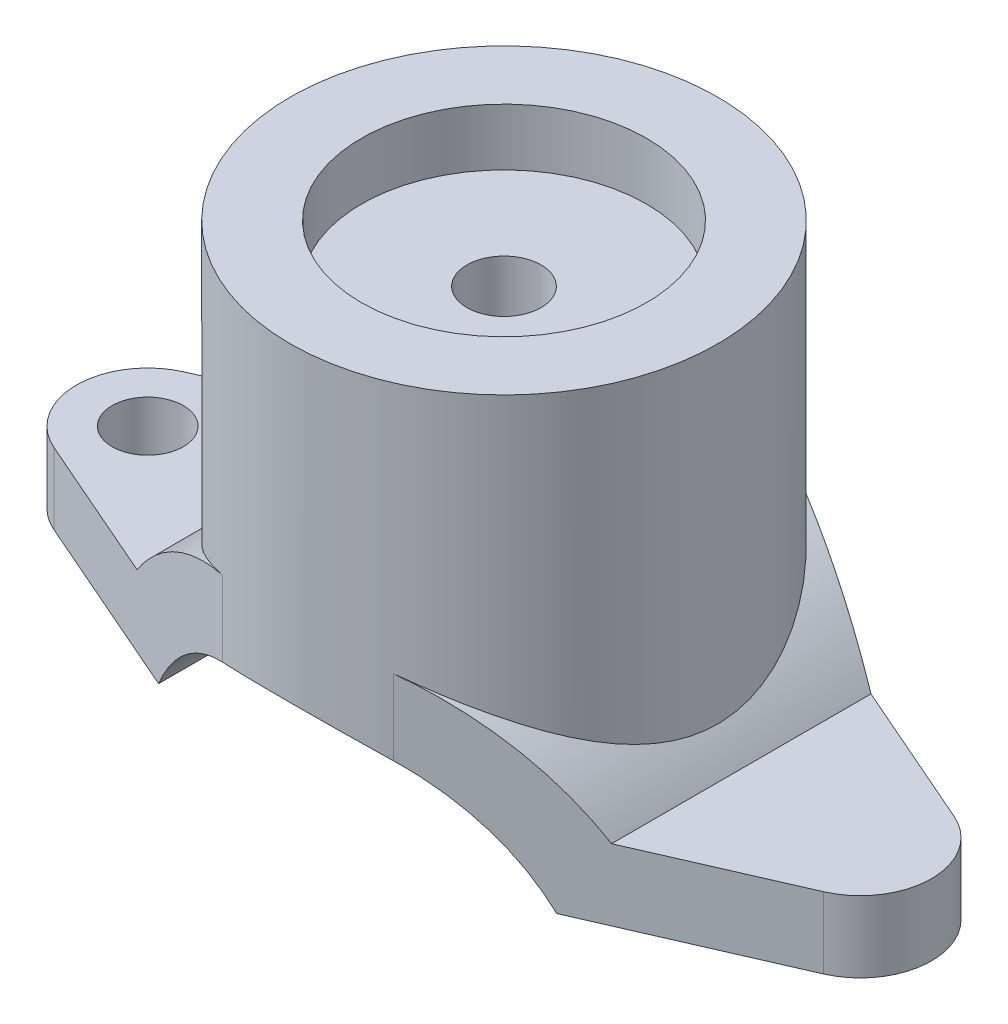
SolidWorks part; units mm, degrees
ref_plane "Front Plane" through (0, 0, 0) normal (0, 0, 1) x (1, 0, 0)
ref_plane "Top Plane" through (0, 0, 0) normal (0, 1, 0) x (1, 0, 0)
ref_plane "Right Plane" through (0, 0, 0) normal (1, 0, 0) x (0, 0, -1)
sketch "Sketch1" plane through (0, 0, 0) normal (0, 0, 1) x (1, 0, 0)
  line L0 (219.8498, 0) -> (300, 0)
  line L1 (0, 0) -> (80.1502, 0)
  line L2 (0, 0) -> (0, 25)
  line L3 (0, 25) -> (66.7594, 25)
  line L4 (300, 0) -> (300, 25)
  line L5 (233.2406, 25) -> (300, 25)
  arc A0 (219.8498, 0) -> (80.1502, 0) centre (150, -39) ccw
  arc A1 (233.2406, 25) -> (66.7594, 25) centre (150, -39) ccw
  dimension "D3" = 39
  dimension "D1" = 300
  dimension "D2" = 25
extrude "Boss-Extrude1" add sketch "Sketch1" along normal mid plane 150
ref_plane "Plane1" through (150, 66, 75) normal (0, 1, 0) x (1, 0, 0)
sketch "Sketch2" plane through (150, 66, 75) normal (0, 1, 0) x (1, 0, 0)
  line L0 (-150, 0) -> (-150, 150) construction
  line L1 (150, 0) -> (150, 150) construction
  line L2 (-135, 97.9129) -> (-30, 143.7386)
  line L3 (30, 143.7386) -> (135, 97.9129)
  line L4 (-135, 52.0871) -> (-30, 6.2614)
  line L5 (30, 6.2614) -> (135, 52.0871)
  arc A0 (-30, 6.2614) -> (30, 6.2614) centre (0, 75) ccw
  arc A1 (-135, 97.9129) -> (-135, 52.0871) centre (-125, 75) ccw
  arc A2 (135, 52.0871) -> (135, 97.9129) centre (125, 75) ccw
  arc A3 (30, 143.7386) -> (-30, 143.7386) centre (0, 75) ccw
  dimension "D1" = 150
  dimension "D2" = 25
  dimension "D3" = 25
extrude "Cut-Extrude1" cut sketch "Sketch2" against normal through all flip side to cut
ref_plane "Plane2" through (0, 150, 0) normal (0, 1, 0) x (1, 0, 0)
sketch "Sketch3" plane through (0, 150, 0) normal (0, 1, 0) x (1, 0, 0)
  circle A0 centre (150, 0) radius 75
  dimension "D1" = 150
extrude "Boss-Extrude2" add sketch "Sketch3" against normal up to surface (84 mm away)
hole_wizard "CBORE for M24 Hex Head Cap Screw1" positions "Sketch4" profile "Sketch5" counterbore size "M24" standard "ANSI Metric"
sketch "Sketch4" plane through (0, 150, 0) normal (0, 1, 0) x (1, 0, 0)
  circle A2 centre (150, 0) radius 75 construction
  point P0 (150, 0)
  point P3 (0, 0)
  point P8 (0, 0)
sketch "Sketch5" plane through (150, 150, 0) normal (1, 0, 0) x (0, 0, 1)
  line L0 (0, 0) -> (0, 150)
  line L1 (0, 150) -> (13, 150)
  line L2 (-75, 0) -> (75, 0) construction
  line L3 (13, 150) -> (13, 20)
  line L4 (13, 20) -> (50, 20)
  line L5 (50, 20) -> (50, 0)
  line L7 (50, 0) -> (0, 0)
  line L11 (0, -6.35) -> (0, 107.95) construction
  point P6 (0, 0)
  dimension "Thru Hole Dia." = 26
  dimension "Thru Hole Depth" = 150
  dimension "C'Bore Dia." = 100
  dimension "C'Bore Depth" = 20
other "Hole1" parameters "D1"=25
sketch "Sketch6" plane through (0, 25, 0) normal (0, 1, 0) x (1, 0, 0)
  circle A0 centre (25, 0) radius 12.5
  arc A1 (15, 22.9129) -> (15, -22.9129) centre (25, 0) ccw construction
  dimension "D1" = 25
